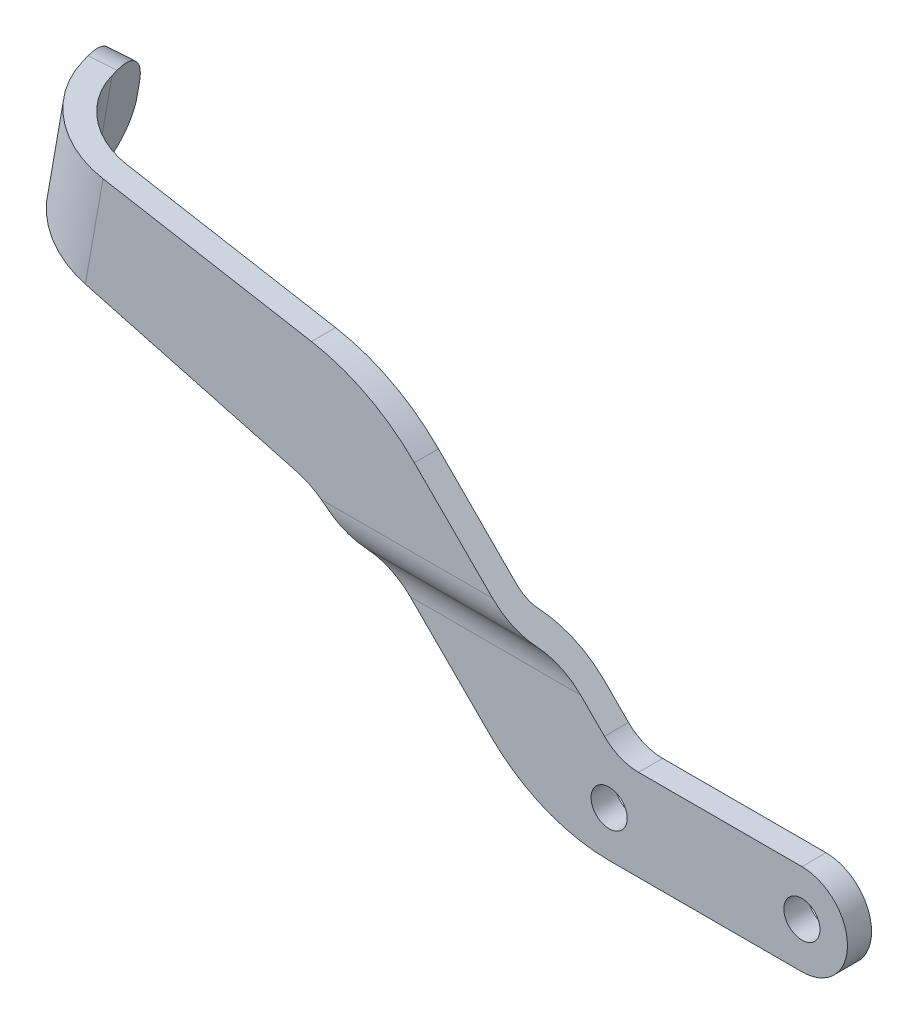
SolidWorks part; units mm, degrees
ref_plane "Plane1" through (0, 0, 0) normal (0, 0, 1) x (1, 0, 0)
ref_plane "Plane2" through (0, 0, 0) normal (0, 1, 0) x (1, 0, 0)
ref_plane "Plane3" through (0, 0, 0) normal (1, 0, 0) x (0, 0, -1)
mirrored part "CLAMP_ARM_L_Mirrored"
other "<CLAMP_ARM_L>-<Fillet4>"
